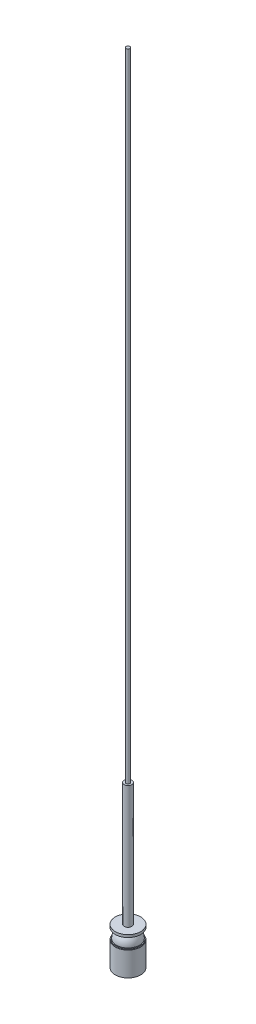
SolidWorks part; units mm, degrees
ref_plane "Front Plane" through (0, 0, 0) normal (0, 0, 1) x (1, 0, 0)
ref_plane "Top Plane" through (0, 0, 0) normal (0, 1, 0) x (1, 0, 0)
ref_plane "Right Plane" through (0, 0, 0) normal (1, 0, 0) x (0, 0, -1)
sketch "Sketch1" plane through (0, 0, 0) normal (0, 0, 1) x (1, 0, 0)
  line L0 (0, 0) -> (0, 193)
  line L1 (0, 193) -> (6, 193)
  line L2 (6, 193) -> (6, 0)
  line L3 (6, 0) -> (0, 0)
  dimension "D1" = 193
  dimension "D2" = 6
revolve "Revolve1" add sketch "Sketch1" angle 360 about L0
sketch "Sketch2" plane through (0, 0, 0) normal (0, 0, 1) x (1, 0, 0)
  line L0 (0, 0) -> (20, 0)
  line L1 (20, 0) -> (20, -4)
  line L2 (20, -4) -> (0, -4)
  line L3 (0, -4) -> (0, 0)
  dimension "D1" = 20
  dimension "D2" = 4
revolve "Revolve2" add sketch "Sketch2" angle 360 about L3
sketch "Sketch3" plane through (0, 0, 0) normal (0, 0, 1) x (1, 0, 0)
  line L0 (0, -4) -> (0, -59)
  line L1 (-20, -4) -> (20, -4) construction
  line L2 (0, -59) -> (20, -59)
  line L3 (20, -59) -> (20, -21)
  line L4 (20, -21) -> (19.3133, -21)
  line L5 (19.3133, -21) -> (19.3133, -19.47)
  line L6 (19.3133, -19.47) -> (18.1254, -19.47)
  line L7 (0, -4) -> (10.0909, -4)
  arc A0 (10.0909, -4) -> (18.1254, -19.47) centre (0.9307, -18.5788) cw
  point P12 (19.3133, -21)
  point P13 (18.1254, -19.47)
  dimension "D1" = 55
  dimension "D2" = 20
  dimension "D3" = 38
revolve "Revolve3" add sketch "Sketch3" angle 360 about L0
sketch "Sketch4" plane through (0, 0, 0) normal (0, 0, 1) x (1, 0, 0)
  line L0 (0, 193) -> (0, 1193)
  line L1 (6, 193) -> (-6, 193) construction
  line L2 (0, 1193) -> (3, 1193)
  line L3 (3, 1193) -> (3, 193)
  line L4 (3, 193) -> (0, 193)
  point P7 (0, 0)
  point P8 (0, 0)
  point P9 (0, 0)
  dimension "D1" = 3
  dimension "D2" = 1000
revolve "Revolve4" add sketch "Sketch4" angle 360 about L0
